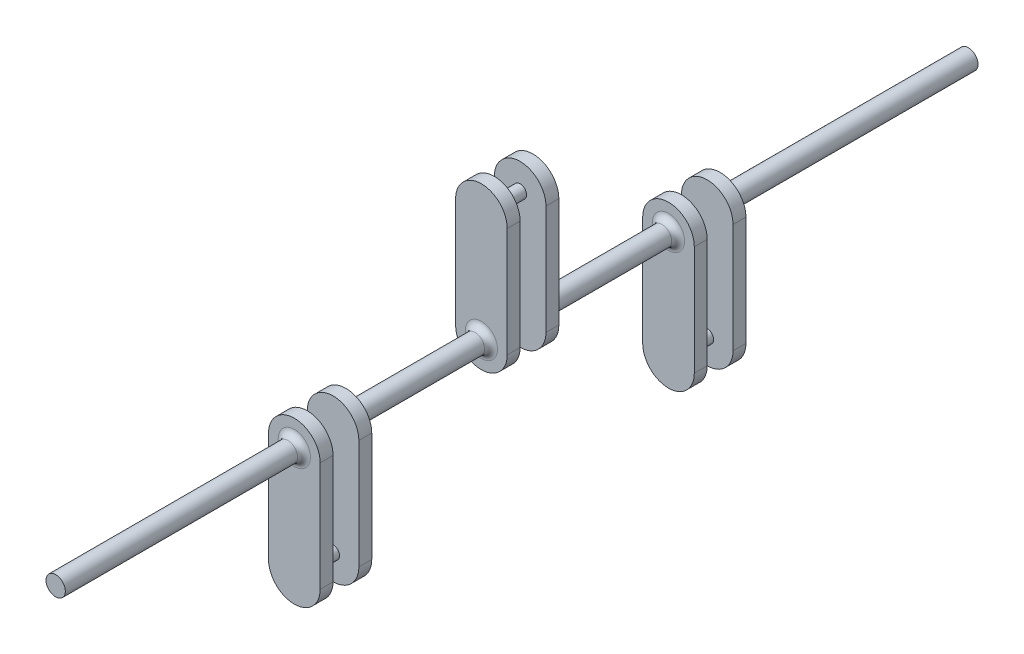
SolidWorks part; units mm, degrees
ref_plane "Front Plane" through (0, 0, 0) normal (0, 0, 1) x (1, 0, 0)
ref_plane "Top Plane" through (0, 0, 0) normal (0, 1, 0) x (1, 0, 0)
ref_plane "Right Plane" through (0, 0, 0) normal (1, 0, 0) x (0, 0, -1)
sketch "Sketch1" plane through (0, 0, 0) normal (0, 0, 1) x (1, 0, 0)
  circle A0 centre (0, 0) radius 9.525
  dimension "D1" = 19.05
extrude "Boss-Extrude1" add sketch "Sketch1" along normal blind 762
ref_plane "Plane1" through (0, 0, 107.95) normal (0, 0, -1) x (-1, 0, 0)
sketch "Sketch2" plane through (0, 0, 107.95) normal (0, 0, -1) x (-1, 0, 0)
  line L0 (0, -107.7468) -> (0, 0) construction
  line L3 (-25.4, -107.7468) -> (-25.4, 0)
  line L4 (25.4, -107.7468) -> (25.4, 0)
  circle A2 centre (0, -107.7468) radius 6.35
  arc A3 (-25.4, -107.7468) -> (25.4, -107.7468) centre (0, -107.7468) ccw
  arc A4 (25.4, 0) -> (-25.4, 0) centre (0, 0) ccw
  circle A5 centre (0, 0) radius 9.525
  point P3 (0, -53.8734)
  dimension "D1" = 12.7
  dimension "D3" = 19.05
  dimension "D4" = 25.4
  dimension "D2" = 107.7468
extrude "Boss-Extrude2" add sketch "Sketch2" against normal blind 12.7
sketch "Sketch3" plane through (0, 0, 120.65) normal (0, 0, 1) x (1, 0, 0)
  line L0 (25.4, -107.7468) -> (25.4, 0) construction
  line L1 (-25.4, 0) -> (-25.4, -107.7468) construction
  line L2 (25.4, -107.7468) -> (25.4, 0)
  line L3 (-25.4, 0) -> (-25.4, -107.7468)
  circle A0 centre (0, 0) radius 9.525 construction
  arc A1 (-25.4, -107.7468) -> (25.4, -107.7468) centre (0, -107.7468) ccw construction
  arc A2 (25.4, 0) -> (-25.4, 0) centre (0, 0) ccw construction
  circle A3 centre (0, 0) radius 9.525
  arc A4 (-25.4, -107.7468) -> (25.4, -107.7468) centre (0, -107.7468) ccw
  arc A5 (25.4, 0) -> (-25.4, 0) centre (0, 0) ccw
ref_plane "Plane3" through (0, 0, 133.35) normal (0, 0, 1) x (1, 0, 0)
mirror "Mirror1" about plane through (0, 0, 133.35) normal (0, 0, 1) of "Boss-Extrude2"
sketch "Sketch4" plane through (0, 0, 107.95) normal (0, 0, -1) x (-1, 0, 0)
  circle A0 centre (0, -107.7468) radius 6.35 construction
  circle A1 centre (0, -107.7468) radius 6.35
extrude "Boss-Extrude3" add sketch "Sketch4" against normal up to surface (50.8 mm away)
sketch "Sketch5" plane through (0, 0, 120.65) normal (0, 0, 1) x (1, 0, 0)
  circle A0 centre (0, 0) radius 9.525 construction
  circle A1 centre (0, 0) radius 9.525
extrude "Cut-Extrude1" cut sketch "Sketch5" along normal up to surface (25.4 mm away)
fillet "Fillet1" radius 6.35 2 edges at (-9.525, 0, 158.75) (-9.525, 0, 107.95)
pattern_linear "LPattern1" count 2 spacing 368.3 along (0, 0, 1) of "Boss-Extrude2", "Mirror1", "Boss-Extrude3", "Cut-Extrude1"
ref_plane "Plane4" through (0, 0, 317.5) normal (0, 0, 1) x (1, 0, 0)
ref_plane "Plane5" through (0, 0, 330.2) normal (0, 0, 1) x (1, 0, 0)
sketch "Sketch6" plane through (0, 0, 330.2) normal (0, 0, 1) x (1, 0, 0)
  line L0 (0, 107.7468) -> (0, 0) construction
  line L1 (25.4, 107.7468) -> (25.4, 0)
  line L2 (-25.4, 107.7468) -> (-25.4, 0)
  circle A0 centre (0, 107.7468) radius 6.35
  arc A1 (25.4, 107.7468) -> (-25.4, 107.7468) centre (0, 107.7468) ccw
  arc A2 (-25.4, 0) -> (25.4, 0) centre (0, 0) ccw
  circle A3 centre (0, 0) radius 9.525
  point P2 (0, 53.8734)
  dimension "D1" = 12.7
  dimension "D3" = 19.05
  dimension "D4" = 25.4
  dimension "D2" = 107.7468
extrude "Boss-Extrude4" add sketch "Sketch6" along normal blind 12.7
mirror "Mirror2" about plane through (0, 0, 317.5) normal (0, 0, 1) of "Boss-Extrude4"
sketch "Sketch7" plane through (0, 0, 292.1) normal (0, 0, -1) x (-1, 0, 0)
  circle A0 centre (0, 107.7468) radius 6.35 construction
  circle A1 centre (0, 107.7468) radius 6.35
extrude "Boss-Extrude5" add sketch "Sketch7" against normal up to surface (50.8 mm away)
sketch "Sketch8" plane through (0, 0, 330.2) normal (0, 0, -1) x (-1, 0, 0)
  circle A0 centre (0, 0) radius 9.525 construction
  circle A1 centre (0, 0) radius 9.525
extrude "Cut-Extrude4" cut sketch "Sketch8" along normal up to surface (25.4 mm away)
sketch "Sketch9" plane through (0, 0, 488.95) normal (0, 0, 1) x (1, 0, 0)
  circle A0 centre (0, 0) radius 9.525 construction
  circle A1 centre (0, 0) radius 9.525
extrude "Cut-Extrude5" cut sketch "Sketch9" along normal up to surface (25.4 mm away)
fillet "Fillet2" radius 6.35 4 edges at (-9.525, 0, 292.1) (-9.525, 0, 476.25) (9.525, 0, 527.05) (9.525, 0, 342.9)
sketch "Sketch10" plane through (0, 0, 0) normal (0, 0, -1) x (-1, 0, 0)
  circle A1 centre (0, 0) radius 9.525
  circle A2 centre (0, 0) radius 9.525
  dimension "D1" = 0
extrude "Boss-Extrude6" add sketch "Sketch10" along normal blind 136.398
